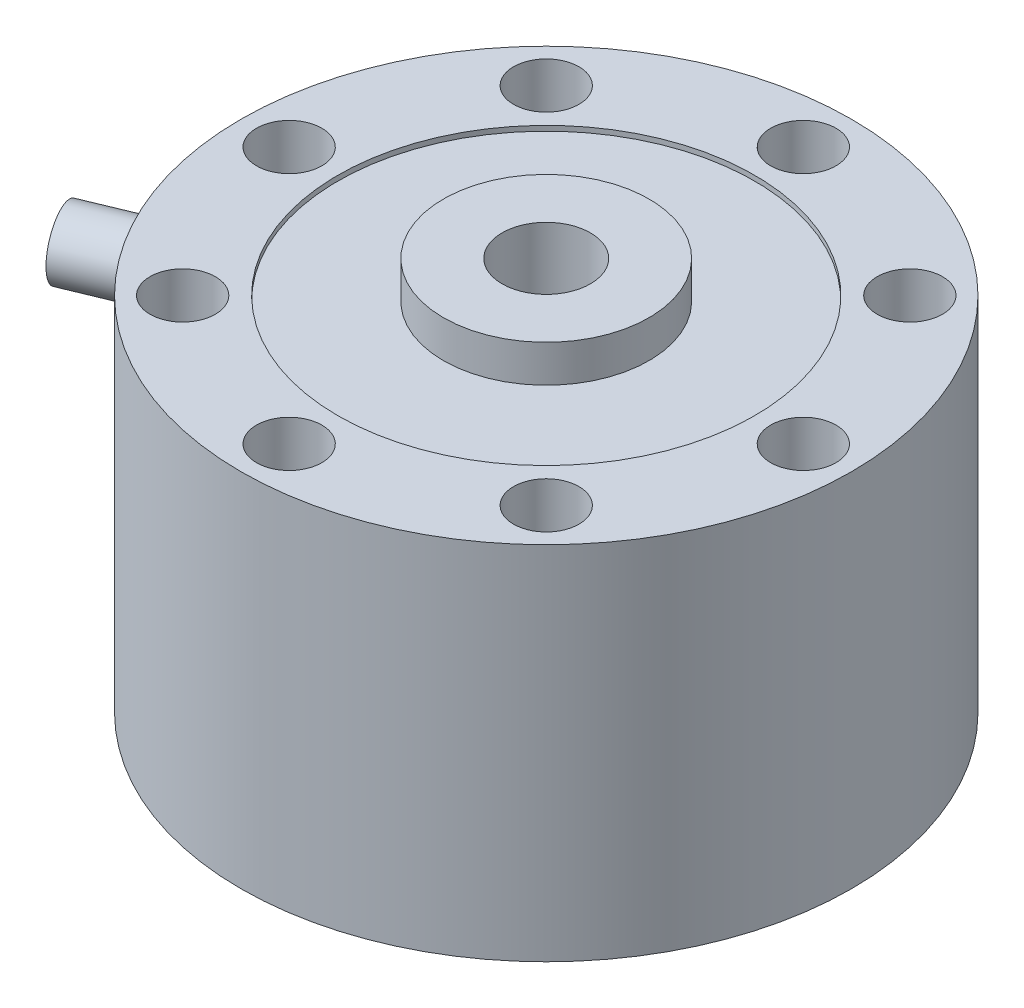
SolidWorks part; units mm, degrees
ref_plane "Front Plane" through (0, 0, 0) normal (0, 0, 1) x (1, 0, 0)
ref_plane "Top Plane" through (0, 0, 0) normal (0, 1, 0) x (1, 0, 0)
ref_plane "Right Plane" through (0, 0, 0) normal (1, 0, 0) x (0, 0, -1)
sketch "Sketch1" plane through (0, 0, 0) normal (0, 1, 0) x (1, 0, 0)
  circle A0 centre (0, 0) radius 60.325
  dimension "D1" = 120.65
extrude "Boss-Extrude1" add sketch "Sketch1" along normal blind 71.374 contours A0
sketch "Sketch2" plane through (0, 71.374, 0) normal (0, 1, 0) x (1, 0, 0)
  circle A0 centre (0, 0) radius 20.32
  dimension "D1" = 40.64
extrude "Boss-Extrude2" add sketch "Sketch2" along normal blind 6.35 contours A0
sketch "Sketch3" plane through (0, 0, 0) normal (0, -1, 0) x (1, 0, 0)
  circle A0 centre (0, 0) radius 20.32
  dimension "D1" = 40.64
extrude "Boss-Extrude3" add sketch "Sketch3" along normal blind 1.27 contours A0
hole_wizard "3/4-16 Tapped Hole1" positions "Sketch5" profile "Sketch4" tap size "3/4-16" standard "ANSI Inch"
sketch "Sketch5" plane through (0, 77.724, 0) normal (0, 1, 0) x (1, 0, 0)
  point P0 (0, 0)
sketch "Sketch4" plane through (0, 77.724, 0) normal (1, 0, 0) x (0, 0, 1)
  line L0 (0, 0) -> (0, 44.3877)
  line L1 (0, 44.3877) -> (8.7312, 39.1414)
  line L2 (8.7312, 39.1414) -> (8.7312, 0)
  line L5 (8.7312, 0) -> (0, 0)
  line L10 (0, 44.3877) -> (-8.7313, 39.1414) construction
  line L11 (0, -6.35) -> (0, 107.95) construction
  dimension "Tap Drill Dia." = 17.4625
  dimension "Tap Drill Depth" = 39.1414
  dimension "Drill Angle" = 118
hole_wizard "3/4-16 Tapped Hole2" positions "Sketch13" profile "Sketch12" tap size "3/4-16" standard "ANSI Inch"
sketch "Sketch13" plane through (0, -1.27, 0) normal (0, -1, 0) x (-1, 0, 0)
  point P0 (0, 0)
sketch "Sketch12" plane through (0, -1.27, 0) normal (1, 0, 0) x (0, 0, -1)
  line L0 (0, 0) -> (0, 25.8457)
  line L1 (0, 25.8457) -> (8.7312, 20.5994)
  line L2 (8.7312, 20.5994) -> (8.7312, 0)
  line L5 (8.7312, 0) -> (0, 0)
  line L10 (0, 25.8457) -> (-8.7313, 20.5994) construction
  line L11 (0, -6.35) -> (0, 107.95) construction
  dimension "Tap Drill Dia." = 17.4625
  dimension "Tap Drill Depth" = 20.5994
  dimension "Drill Angle" = 118
sketch "Sketch18" plane through (0, 71.374, 0) normal (0, 1, 0) x (1, 0, 0)
  line L0 (0, 0) -> (0, 87.1456) construction
  circle A0 centre (0, 0) radius 50.8 construction
  circle A1 centre (0, 50.8) radius 4.3561
  dimension "D1" = 101.6
  dimension "D2" = 8.7122
extrude "Cut-Extrude2" cut sketch "Sketch18" against normal through all
sketch "Sketch19" plane through (0, 71.374, 0) normal (0, 1, 0) x (1, 0, 0)
  circle A0 centre (0, 50.8) radius 6.4516
  dimension "D1" = 12.9032
extrude "Cut-Extrude3" cut sketch "Sketch19" against normal blind 10.16
pattern_circular "CirPattern1" count 8 over 360 about axis through (0, 0, 0) along (0, 1, 0) of "Cut-Extrude2", "Cut-Extrude3"
sketch "Sketch20" plane through (0, 71.374, 0) normal (0, 1, 0) x (1, 0, 0)
  circle A0 centre (0, 0) radius 20.32
  circle A1 centre (0, 0) radius 41.17
  circle A2 centre (0, 0) radius 20.32 construction
  dimension "D1" = 0
extrude "Cut-Extrude4" cut sketch "Sketch20" against normal blind 1
sketch "Sketch21" plane through (0, 71.374, 0) normal (0, 1, 0) x (1, 0, 0)
  line L0 (0, 0) -> (-97.5167, 0) construction
  line L1 (0, 0) -> (-104.1507, -43.1406) construction
  line L2 (-74.3113, 21.7665) -> (-40.9329, -58.8161) construction
  dimension "D1" = 22.5
  dimension "D2" = 90
  dimension "D3" = 60.325
ref_plane "Plane1" through (-55.733, 0, 23.0854) normal (-0.9239, 0, 0.3827) x (0.3827, 0, 0.9239)
sketch "Sketch22" plane through (-55.733, 0, 23.0854) normal (-0.9239, 0, 0.3827) x (0.3827, 0, 0.9239)
  circle A0 centre (0, 60.7186) radius 6.35
  point P2 (0, 60.7186)
  dimension "D1" = 12.7
extrude "Boss-Extrude4" add sketch "Sketch22" along normal blind 12.7 and the other way up to surface
